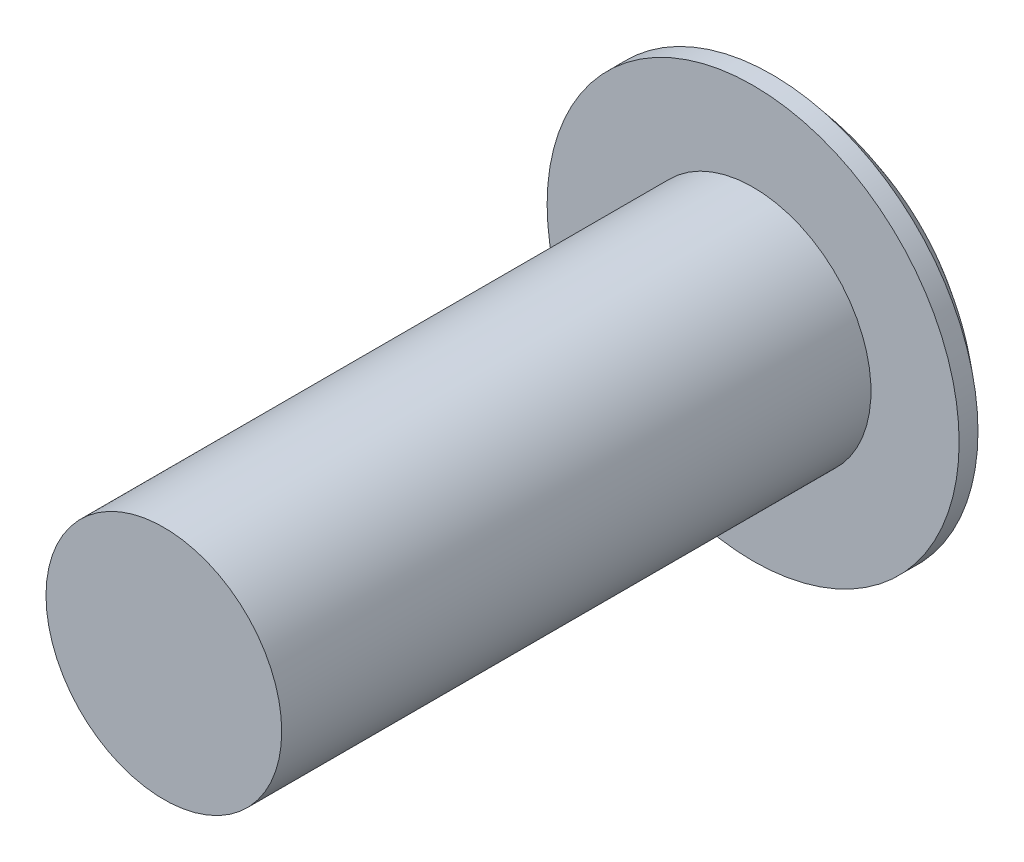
SolidWorks part; units mm, degrees
ref_plane "Front Plane" through (0, 0, 0) normal (0, 0, 1) x (1, 0, 0)
ref_plane "Top Plane" through (0, 0, 0) normal (0, 1, 0) x (1, 0, 0)
ref_plane "Right Plane" through (0, 0, 0) normal (1, 0, 0) x (0, 0, -1)
sketch "Sketch1" plane through (0, 0, 0) normal (1, 0, 0) x (0, 0, -1)
  line L0 (0, 0) -> (3.3528, 0)
  line L1 (0, 5.5499) -> (0.508, 5.5499)
  line L2 (0, 0) -> (0, 5.5499)
  line L3 (0, 0) -> (15.0876, 0) construction
  arc A0 (0.508, 5.5499) -> (3.3528, 0) centre (-9.0254, -2.8408) cw
  dimension "HeadRadius" = 12.7
  dimension "Head Height" = 3.3528
  dimension "Head dia/2" = 5.5499
  dimension "1/4ofHeight" = 0.508
revolve "Revolve1" add sketch "Sketch1" angle 360 about L3
sketch "Sketch2" plane through (0, 0, 0) normal (0, 0, 1) x (1, 0, 0)
  circle A0 centre (0, 0) radius 3.175
extrude "Extrude1" add sketch "Sketch2" along normal blind 15.875
sketch "Sketch3" plane through (0, 0, 0) normal (0, 0, 1) x (1, 0, 0)
  line L1 (-1.0839, 2.0188) -> (-2.2903, 0.0707)
  line L2 (-2.2903, 0.0707) -> (-1.2063, -1.9481)
  line L3 (-1.2063, -1.9481) -> (1.0839, -2.0188)
  line L4 (1.0839, -2.0188) -> (2.2903, -0.0707)
  line L5 (2.2903, -0.0707) -> (1.2063, 1.9481)
  line L6 (1.2063, 1.9481) -> (-1.0839, 2.0188)
  circle A0 centre (0, 0) radius 1.9844 construction
extrude "Extrude2" cut sketch "Sketch3" against normal blind 6.35
